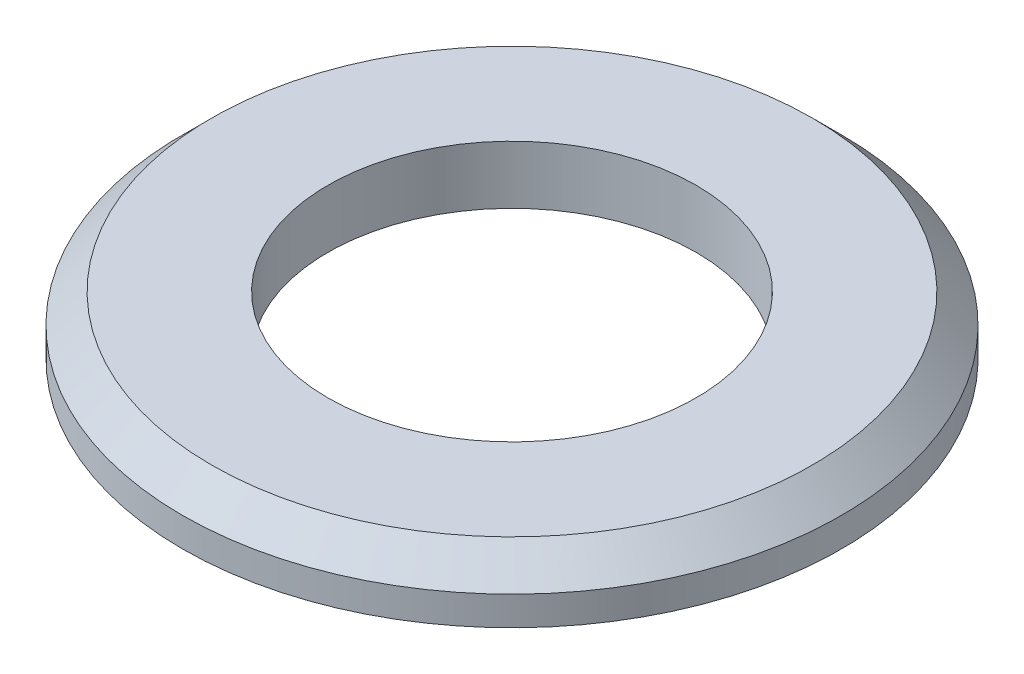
SolidWorks part; units mm, degrees
ref_plane "Front" through (0, 0, 0) normal (0, 0, 1) x (1, 0, 0)
ref_plane "Top" through (0, 0, 0) normal (0, 1, 0) x (1, 0, 0)
ref_plane "Right" through (0, 0, 0) normal (1, 0, 0) x (0, 0, -1)
sketch "Sketch1" plane through (0, 0, 0) normal (0, 1, 0) x (1, 0, 0)
  circle A0 centre (0, 0) radius 9.5
  circle A1 centre (0, 0) radius 17
extrude "Extrude1" add sketch "Sketch1" along normal blind 3
chamfer "Chamfer1" distance 1.5 1 edges at (0, 3, 17)
